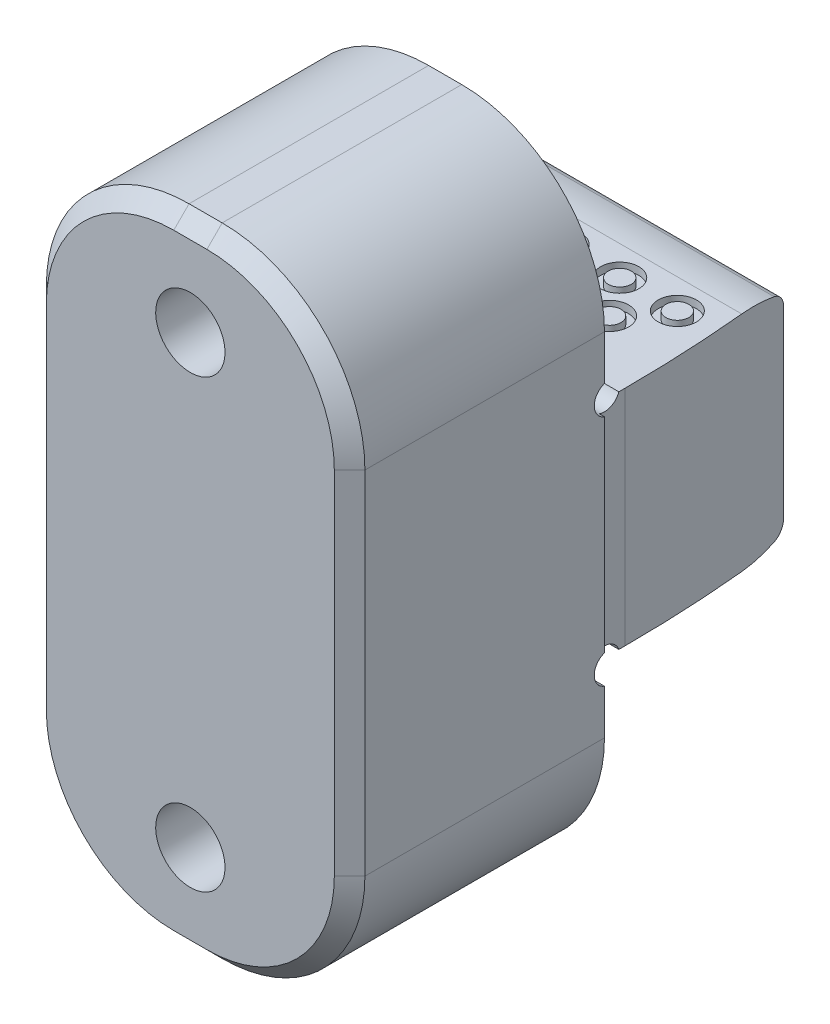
SolidWorks part; units mm, degrees
ref_plane "Front Plane" through (0, 0, 0) normal (0, 0, 1) x (1, 0, 0)
ref_plane "Top Plane" through (0, 0, 0) normal (0, 1, 0) x (1, 0, 0)
ref_plane "Right Plane" through (0, 0, 0) normal (1, 0, 0) x (0, 0, -1)
sketch "Sketch3" plane through (0, 0, 0) normal (1, 0, 0) x (0, 0, -1)
  line L0 (0, 8.7312) -> (0, -8.7312) construction
  line L1 (-12.7, -15.875) -> (0, -15.875)
  line L2 (-12.7, -15.875) -> (-12.7, 15.875)
  line L3 (-12.7, 15.875) -> (0, 15.875)
  line L4 (9.7536, -5.5601) -> (9.7536, 5.5601)
  line L6 (0, -15.875) -> (0, -5.5601)
  line L7 (0, -5.5601) -> (9.7536, -5.5601)
  line L8 (0, 15.875) -> (0, 5.5601)
  line L9 (0, 5.5601) -> (9.7536, 5.5601)
  line L10 (0, 0) -> (50000, 0) construction
  dimension "D1" = 22.4536
  dimension "D2" = 12.7
  dimension "D3" = 31.75
  dimension "D4" = 11.1201
extrude "Extrude1" add sketch "Sketch3" along normal mid plane 15.875
sketch "Sketch7" plane through (7.9375, 0, 0) normal (1, 0, 0) x (0, 0, -1)
  line L1 (0, -14.5526) -> (21.9683, -14.5526)
  line L2 (0, -14.5526) -> (0, 17.1683)
  line L3 (0, 17.1683) -> (21.9683, 17.1683)
  line L4 (21.9683, -14.5526) -> (21.9683, 17.1683)
  line L5 (0, -15.875) -> (0, -5.5601) construction
extrude "Cut-Extrude3" cut sketch "Sketch7" against normal blind 0.254
mirror "Mirror2" about plane through (0, 0, 0) normal (1, 0, 0) of "Cut-Extrude3"
sketch "Sketch8" plane through (7.9375, 0, 0) normal (1, 0, 0) x (0, 0, -1)
  line L0 (0, 0) -> (50000, 0) construction
  line L1 (0, -15.875) -> (0, 15.875) construction
  line L2 (0, 5.5601) -> (9.7536, 5.5601) construction
  circle A0 centre (0.254, 5.8141) radius 0.762
  circle A1 centre (0.254, -5.8141) radius 0.762
  dimension "D1" = 0.762
  dimension "D2" = 0.508
  dimension "D3" = 0.508
extrude "Cut-Extrude4" cut sketch "Sketch8" against normal through all
sketch "Sketch9" plane through (7.9375, 0, 0) normal (1, 0, 0) x (0, 0, -1)
  line L0 (0.9724, 5.5601) -> (9.7536, 5.5601) construction
  line L1 (9.7536, 5.5601) -> (9.7536, -5.5601) construction
  line L2 (0, 0) -> (50000, 0) construction
  line L3 (9.7536, 4.564) -> (13.7414, 4.564)
  line L4 (7.3914, 5.5601) -> (7.3914, 10.914)
  line L5 (7.3914, 10.914) -> (13.7414, 10.914)
  line L6 (13.7414, 4.564) -> (13.7414, 10.914)
  line L7 (13.7414, -4.564) -> (13.7414, -10.914)
  line L8 (7.3914, -10.914) -> (13.7414, -10.914)
  line L9 (7.3914, -5.5601) -> (7.3914, -10.914)
  line L10 (9.7536, -4.564) -> (13.7414, -4.564)
  arc A0 (7.3914, 5.5601) -> (9.2098, 5.2941) centre (7.3914, -0.7899) cw
  arc A1 (9.2098, 5.2941) -> (9.7536, 4.564) centre (8.9916, 4.564) cw
  arc A2 (9.2098, -5.2941) -> (9.7536, -4.564) centre (8.9916, -4.564) ccw
  arc A3 (7.3914, -5.5601) -> (9.2098, -5.2941) centre (7.3914, 0.7899) ccw
  dimension "D1" = 0.762
  dimension "D2" = 6.35
  dimension "D3" = 2.3622
  dimension "D4" = 6.35
  dimension "D5" = 6.35
extrude "Cut-Extrude5" cut sketch "Sketch9" against normal through all
sketch "Sketch13" plane through (0, 15.875, 0) normal (0, 1, 0) x (1, 0, 0)
  line L0 (7.6835, 0.9724) -> (7.6835, 7.3914) construction
  line L2 (6.4005, 13.97) -> (19.1005, 13.97)
  line L4 (7.6835, 1.27) -> (19.1005, 1.27)
  line L5 (19.1005, 13.97) -> (19.1005, 1.27)
  arc A0 (6.4005, 13.97) -> (7.6835, 1.27) centre (-55.8165, 1.27) cw
  dimension "D1" = 63.5
  dimension "D2" = 1.27
  dimension "D3" = 12.7
  dimension "D4" = 12.7
extrude "Cut-Extrude6" cut sketch "Sketch13" against normal through all
sketch "Sketch15" plane through (0, 5.5601, 0) normal (0, 1, 0) x (1, 0, 0)
  line L2 (7.9375, -12.7) -> (-7.9375, -12.7) construction
  line L3 (-7.9375, 7.3914) -> (-7.9375, -0.4644) construction
  circle A0 centre (-2.9591, 5.9182) radius 0.9525
  circle A1 centre (-2.9591, 5.9182) radius 0.5715
  circle A2 centre (-0.0889, 5.9182) radius 0.9525
  circle A3 centre (-0.0889, 5.9182) radius 0.5715
  circle A4 centre (-5.8293, 5.9182) radius 0.9525
  circle A5 centre (-5.8293, 5.9182) radius 0.5715
  circle A6 centre (2.7813, 5.9182) radius 0.9525
  circle A7 centre (2.7813, 5.9182) radius 0.5715
  circle A8 centre (5.6515, 5.9182) radius 0.9525
  circle A9 centre (5.6515, 5.9182) radius 0.5715
  circle A10 centre (-1.5621, 4.0132) radius 0.9525
  circle A11 centre (-1.5621, 4.0132) radius 0.5715
  circle A12 centre (1.3081, 4.0132) radius 0.9525
  circle A13 centre (1.3081, 4.0132) radius 0.5715
  circle A14 centre (-4.4323, 4.0132) radius 0.9525
  circle A15 centre (-4.4323, 4.0132) radius 0.5715
  circle A16 centre (4.1783, 4.0132) radius 0.9525
  circle A17 centre (4.1783, 4.0132) radius 0.5715
  dimension "D1" = 18.6182
  dimension "D2" = 1.905
  dimension "D12" = 2.8702
  dimension "D7" = 1.905
  dimension "D8" = 1.143
  dimension "D3" = 2.1082
  dimension "D4" = 1.397
  dimension "D5" = 2.8702
  dimension "D6" = 2.8702
  dimension "D9" = 2.8702
  dimension "D10" = 2.8702
  dimension "D11" = 2.8702
  dimension "D13" = 2.8702
extrude "Cut-Extrude7" cut sketch "Sketch15" against normal blind 0.381
mirror "Mirror1" about plane through (0, 0, 0) normal (0, 1, 0) of "Cut-Extrude7"
hole_wizard "#6 CBORE" positions "Sketch11" profile "Sketch10" counterbore size "#6" standard "ANSI Inch"
sketch "Sketch11" plane through (0, 0, 0) normal (0, 0, -1) x (-1, 0, 0)
  line L0 (0, 0) -> (0, 50000) construction
  line L1 (0, 0) -> (50000, 0) construction
  point P0 (0, 11.1125)
  point P10 (0, -11.1125)
  dimension "D1" = 22.225
sketch "Sketch10" plane through (0, 11.1125, 0) normal (1, 0, 0) x (0, 1, 0)
  line L0 (0, 0) -> (0, 12.7)
  line L1 (0, 12.7) -> (1.651, 12.7)
  line L3 (1.651, 12.7) -> (1.651, 4.3002)
  line L4 (1.651, 4.3002) -> (3.5725, 4.3002)
  line L5 (3.5725, 4.3002) -> (3.5725, 0)
  line L7 (3.5725, 0) -> (0, 0)
  line L11 (0, -6.35) -> (0, 107.95) construction
  dimension "Thru Hole Dia." = 3.302
  dimension "Thru Hole Depth" = 12.7
  dimension "C'Bore Dia." = 7.145
  dimension "C'Bore Depth" = 4.3002
fillet "Fillet1" radius 7.112 4 edges at (-7.9375, 15.875, 6.35) (-7.9375, -15.875, 6.35) (7.9375, 15.875, 6.35) (7.9375, -15.875, 6.35)
chamfer "Chamfer1" distance 0.762 angle 45 8 edges at (0, 15.875, 12.7) (-5.8544, 13.7919, 12.7) (-7.9375, 0, 12.7) (0, -15.875, 12.7) (-5.8544, -13.7919, 12.7) (7.9375, 0, 12.7) (5.8544, 13.7919, 12.7) (5.8544, -13.7919, 12.7)
hole_wizard "#8-32 Tapped Hole1" positions "Sketch17" profile "Sketch16" tap size "#8-32" standard "Ansi Inch"
sketch "Sketch17" plane through (0, 0, 4.3002) normal (0, 0, -1) x (-1, 0, 0)
  point P0 (0, 11.1125)
  point P1 (0, -11.1125)
sketch "Sketch16" plane through (0, 11.1125, 4.3002) normal (1, 0, 0) x (0, 1, 0)
  line L0 (0, 0) -> (0, 8.3998)
  line L1 (0, 8.3998) -> (1.7272, 8.3998)
  line L2 (1.7272, 8.3998) -> (1.7272, 0)
  line L5 (1.7272, 0) -> (0, 0)
  line L11 (0, -6.35) -> (0, 107.95) construction
  dimension "Thread Major Dia." = 3.4544
  dimension "Thru Tap Drill Depth" = 8.3998
